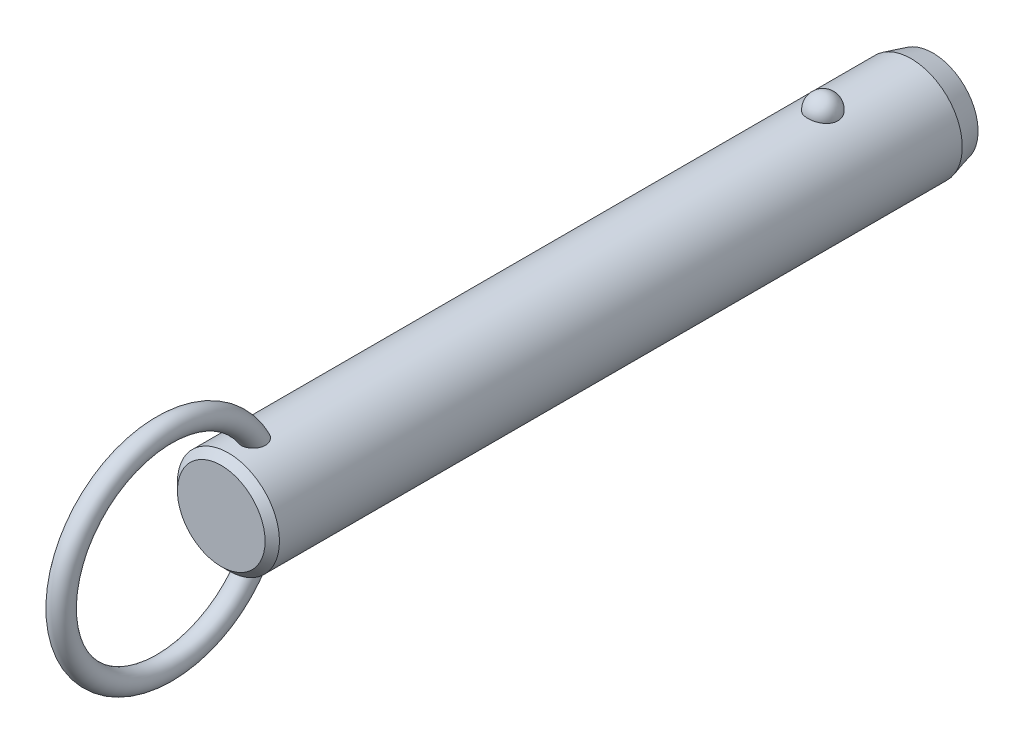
SolidWorks part; units mm, degrees
ref_plane "Front Plane" through (0, 0, 0) normal (0, 0, 1) x (1, 0, 0)
ref_plane "Top Plane" through (0, 0, 0) normal (0, 1, 0) x (1, 0, 0)
ref_plane "Right Plane" through (0, 0, 0) normal (1, 0, 0) x (0, 0, -1)
sketch "Sketch2" plane through (0, 0, 0) normal (0, 0, 1) x (1, 0, 0)
  circle A0 centre (0, 0) radius 7.1
  point P3 (0, 7.1)
  dimension "D1" = 14.2
extrude "Boss-Extrude1" add sketch "Sketch2" along normal blind 73.7
sketch "Sketch3" plane through (0, 0, 0) normal (0, 0, -1) x (-1, 0, 0)
  circle A0 centre (0, 0) radius 7.1
  dimension "D1" = 14.2
extrude "Boss-Extrude2" add sketch "Sketch3" along normal blind 17.4
chamfer "Chamfer1" distance 3 angle 15 1 edges at (-7.1, 0, -17.4)
sketch "Sketch12" plane through (0, 0, 0) normal (1, 0, 0) x (0, 0, -1)
  line L0 (-73.7, 7.1) -> (-73.7, -7.1) construction
  point P0 (-73.7, 0)
sketch "Sketch13" plane through (0, 0, 0) normal (1, 0, 0) x (0, 0, -1)
  circle A0 centre (-89.55, 0) radius 15.85
  point P2 (-73.7, 0)
  dimension "D1" = 31.7
sketch "Sketch14" plane through (0, 0, 0) normal (0, 1, 0) x (1, 0, 0)
  circle A0 centre (0, -75.2) radius 1.5
  point P2 (0, -73.7)
  dimension "D1" = 3
sweep "Sweep1" add profiles "Sketch14" path "Sketch13"
sketch "Sketch15" plane through (0, 0, 73.7) normal (0, 0, 1) x (1, 0, 0)
  circle A0 centre (0, 0) radius 7.1
  dimension "D1" = 14.2
extrude "Boss-Extrude3" add sketch "Sketch15" along normal blind 7.92
chamfer "Chamfer2" distance 1 angle 45 1 edges at (7.1, 0, 81.62)
sketch "Sketch18" plane through (0, 0, 0) normal (1, 0, 0) x (0, 0, -1)
  line L0 (14.4, 7.1) -> (-75.3792, 7.1) construction
  line L1 (2.1, 9.2) -> (2.1, 5)
  line L2 (-75.3792, -7.1) -> (14.4, -7.1) construction
  arc A0 (2.1, 9.2) -> (2.1, 5) centre (2.1, 7.1) ccw
  point P4 (0, 7.1)
  dimension "D1" = 16.3
revolve "Revolve1" add sketch "Sketch18" angle 360 about L1
